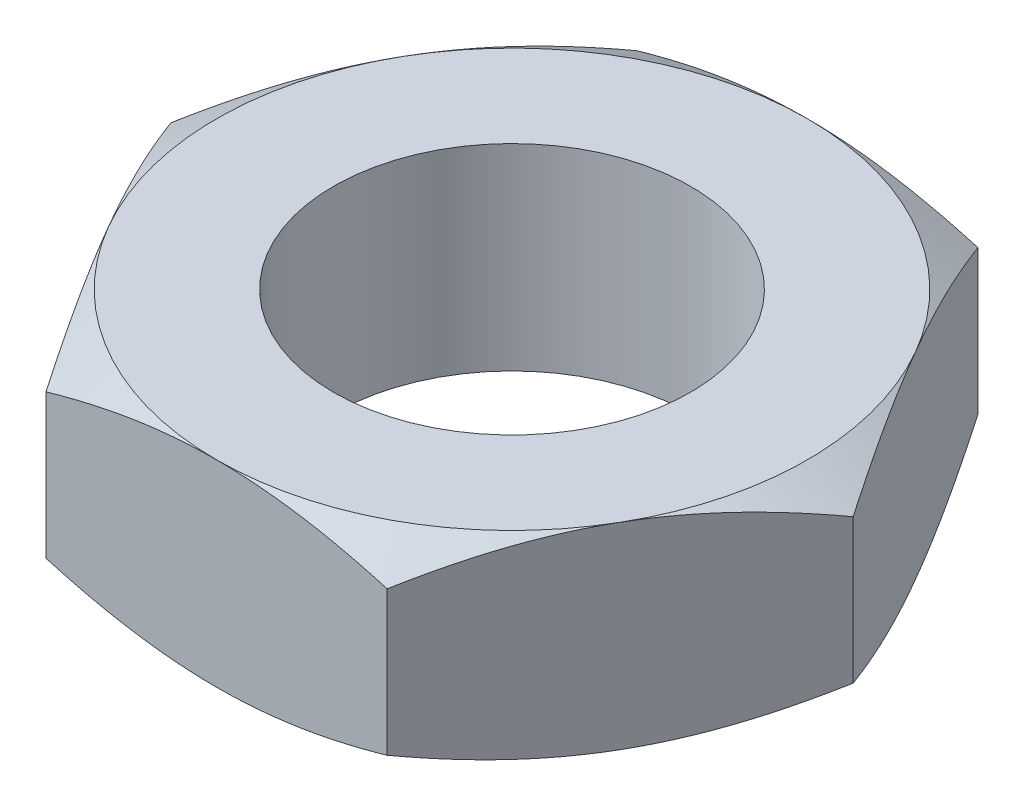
SolidWorks part; units mm, degrees
ref_plane "Front Plane" through (0, 0, 0) normal (0, 0, 1) x (1, 0, 0)
ref_plane "Top Plane" through (0, 0, 0) normal (0, 1, 0) x (1, 0, 0)
ref_plane "Right Plane" through (0, 0, 0) normal (1, 0, 0) x (0, 0, -1)
sketch "Sketch1" plane through (0, 0, 0) normal (0, 1, 0) x (1, 0, 0)
  line L1 (6.9282, -12) -> (13.8564, 0)
  line L2 (13.8564, 0) -> (6.9282, 12)
  line L3 (6.9282, 12) -> (-6.9282, 12)
  line L4 (-6.9282, 12) -> (-13.8564, 0)
  line L5 (-13.8564, 0) -> (-6.9282, -12)
  line L6 (-6.9282, -12) -> (6.9282, -12)
  circle A0 centre (0, 0) radius 12 construction
  dimension "D1" = 24
extrude "Extrude1" add sketch "Sketch1" along normal blind 8
sketch "Sketch2" plane through (0, 0, 0) normal (1, 0, 0) x (0, 0, -1)
  line L0 (-12, 8) -> (-17.1962, 5)
  line L1 (-17.1962, 5) -> (-17.1962, 8)
  line L2 (-17.1962, 8) -> (-12, 8)
  line L3 (-12, 4) -> (0, 4) construction
  line L4 (-12, 8) -> (-12, 0) construction
  line L5 (0, 8) -> (0, 0) construction
  line L6 (-17.1962, 0) -> (-12, 0)
  line L7 (-17.1962, 3) -> (-17.1962, 0)
  line L8 (-12, 0) -> (-17.1962, 3)
  line L9 (0, 0) -> (0, 9.1824) construction
  dimension "D1" = 30
  dimension "D2" = 2
revolve "Cut-Revolve1" cut sketch "Sketch2" angle 360 about L9
hole_wizard "M12x1.5 Tapped Hole1" positions "Sketch4" profile "Sketch3" tap size "M16x1.5" standard "Ansi Metric"
sketch "Sketch4" plane through (0, 8, 0) normal (0, 1, 0) x (-1, 0, 0)
  point P0 (0, 0)
sketch "Sketch3" plane through (0, 8, 0) normal (1, 0, 0) x (0, 0, 1)
  line L0 (0, 0) -> (0, 8)
  line L1 (0, 8) -> (7.25, 8)
  line L2 (7.25, 8) -> (7.25, 0)
  line L5 (7.25, 0) -> (0, 0)
  line L11 (0, -6.35) -> (0, 107.95) construction
  dimension "Thru Tap Drill Dia." = 14.5
  dimension "Thru Tap Drill Depth" = 8
